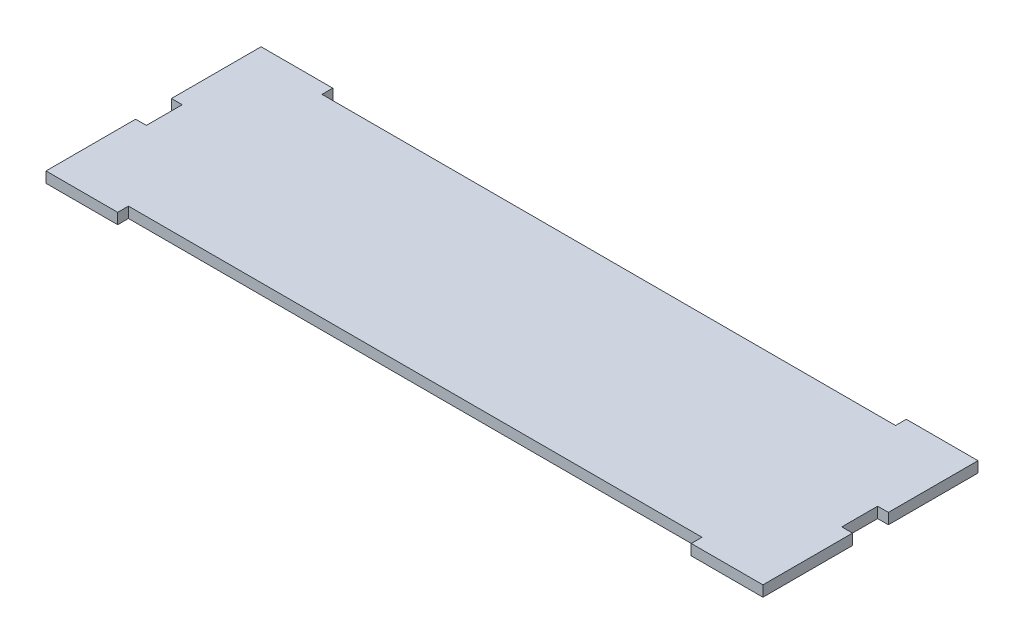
SolidWorks part; units mm, degrees
ref_plane "Front Plane" through (0, 0, 0) normal (0, 0, 1) x (1, 0, 0)
ref_plane "Top Plane" through (0, 0, 0) normal (0, 1, 0) x (1, 0, 0)
ref_plane "Right Plane" through (0, 0, 0) normal (1, 0, 0) x (0, 0, -1)
sketch "Sketch1" plane through (0, 0, 0) normal (0, 1, 0) x (1, 0, 0)
  line L0 (49.6559, -88.6812) -> (49.6559, -113.6812)
  line L1 (-150.3441, -88.6812) -> (-150.3441, -113.6812)
  line L2 (49.6559, -148.6812) -> (29.6559, -148.6812)
  line L3 (-147.3441, -113.6812) -> (-147.3441, -123.6812)
  line L4 (46.6559, -113.6812) -> (46.6559, -123.6812)
  line L5 (49.6559, -123.6812) -> (49.6559, -148.6812)
  line L6 (-150.3441, -123.6812) -> (-147.3441, -123.6812)
  line L7 (49.6559, -113.6812) -> (46.6559, -113.6812)
  line L8 (-150.3441, -123.6812) -> (-150.3441, -148.6812)
  line L9 (-130.3441, -148.6812) -> (-130.3441, -145.6812)
  line L10 (-147.3441, -113.6812) -> (-150.3441, -113.6812)
  line L11 (-150.3441, -88.6812) -> (-130.3441, -88.6812)
  line L12 (29.6559, -91.6812) -> (-130.3441, -91.6812)
  line L13 (46.6559, -123.6812) -> (49.6559, -123.6812)
  line L14 (29.6559, -145.6812) -> (29.6559, -148.6812)
  line L15 (-130.3441, -148.6812) -> (-150.3441, -148.6812)
  line L19 (-130.3441, -145.6812) -> (29.6559, -145.6812)
  line L25 (-130.3441, -91.6812) -> (-130.3441, -88.6812)
  line L26 (29.6559, -91.6812) -> (29.6559, -88.6812)
  line L31 (29.6559, -88.6812) -> (49.6559, -88.6812)
extrude "Boss-Extrude1" add sketch "Sketch1" along normal blind 3
